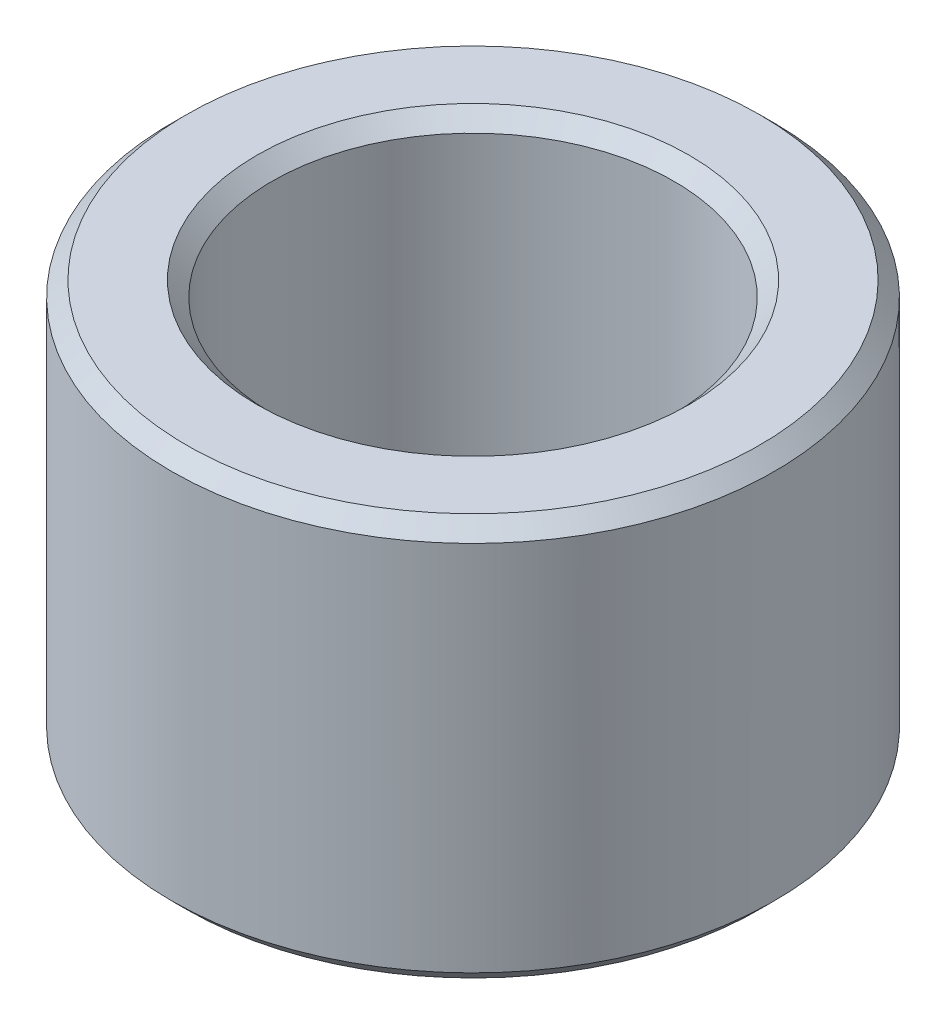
SolidWorks part; units mm, degrees
ref_plane "Plan1" through (0, 0, 0) normal (0, 0, 1) x (1, 0, 0)
ref_plane "Plan2" through (0, 0, 0) normal (0, 1, 0) x (1, 0, 0)
ref_plane "Plan3" through (0, 0, 0) normal (1, 0, 0) x (0, 0, -1)
sketch "Esquisse1" plane through (0, 0, 0) normal (0, 0, 1) x (1, 0, 0)
  line L0 (0, 30) -> (0, -20) construction
  line L1 (4, 8) -> (4, 0)
  line L2 (4, 0) -> (6, 0)
  line L3 (6, 0) -> (6, 8)
  line L4 (6, 8) -> (4, 8)
  dimension "D1" = 8
  dimension "D2" = 4
  dimension "D3" = 6
revolve "Base-Révolution" add sketch "Esquisse1" angle 360 about L0
chamfer "Chanfrein1" distance 0.3 angle 45
